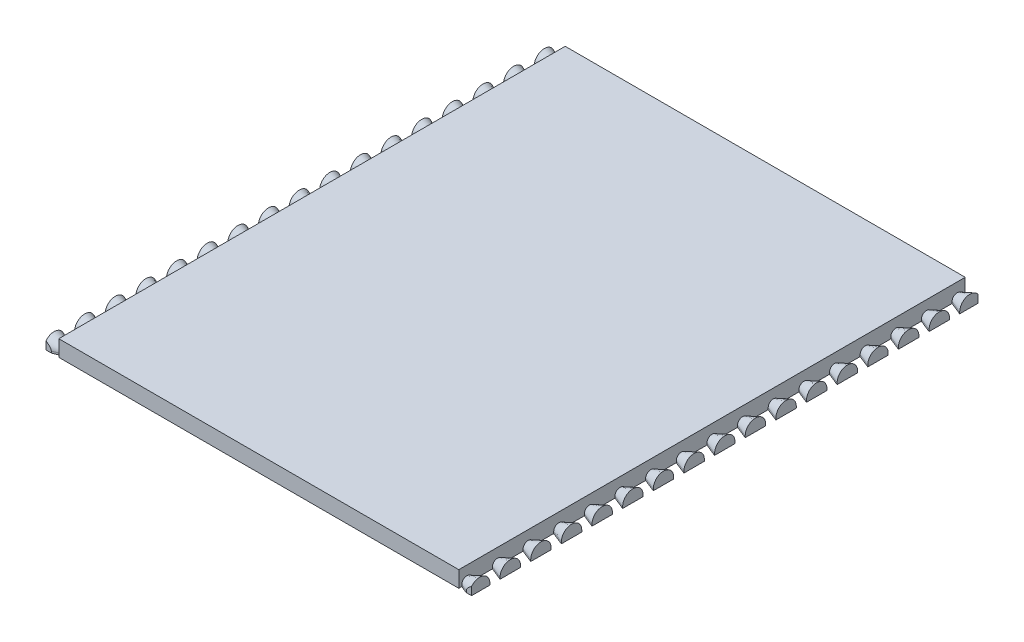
SolidWorks part; units mm, degrees
ref_plane "Alzado" through (0, 0, 0) normal (0, 0, 1) x (1, 0, 0)
ref_plane "Planta" through (0, 0, 0) normal (0, 1, 0) x (1, 0, 0)
ref_plane "Vista lateral" through (0, 0, 0) normal (1, 0, 0) x (0, 0, -1)
sketch "Croquis1" plane through (0, 0, 0) normal (0, 0, 1) x (1, 0, 0)
  line L0 (250, 9.5) -> (-250, -9.5) construction
  line L1 (-250, 9.5) -> (250, 9.5)
  line L2 (-250, 9.5) -> (-250, -9.5)
  line L3 (-250, -9.5) -> (250, -9.5)
  line L4 (250, 9.5) -> (250, -9.5)
extrude "Extruir1" add sketch "Croquis1" along normal mid plane 595
sketch "Croquis2" plane through (0, -9.5, 0) normal (0, -1, 0) x (1, 0, 0)
  line L0 (0, 0) -> (-290.8345, 0) construction
  line L1 (-250, 12) -> (-250, 24)
  line L3 (-250, 297.5) -> (-250, -297.5) construction
  line L4 (-250, 12) -> (-235, 6)
  line L5 (-235, 6) -> (-235, 30)
  line L6 (-235, 30) -> (-250, 24)
  line L7 (-250, 18) -> (-181.4676, 18) construction
  line L8 (0, 0) -> (0, 343.1381) construction
  dimension "D1" = 12
  dimension "D2" = 12
  dimension "D3" = 24
  dimension "D4" = 15
extrude "Cortar-Extruir1" cut sketch "Croquis2" against normal blind 2
sketch "Croquis3" plane through (0, -7.5, 0) normal (0, -1, 0) x (1, 0, 0)
  line L0 (0, 0) -> (-304.3762, 0) construction
  line L4 (-250, 12) -> (-235, 6)
  line L5 (-235, 6) -> (-235, 30)
  line L6 (-235, 30) -> (-250, 24)
  line L7 (-250, 24) -> (-250, 12)
  line L8 (-250, 12) -> (-235, 6)
  line L9 (-235, 6) -> (-235, 30)
  line L10 (-235, 30) -> (-250, 24)
  line L11 (-250, 24) -> (-250, 12)
  dimension "D1" = 0
revolve "Cortar-Revolución1" cut sketch "Croquis3" angle 180 about L0
sketch "Croquis4" plane through (0, 0, -297.5) normal (0, 0, -1) x (-1, 0, 0)
  line L0 (235, -7.5) -> (235, 9.5) construction
  line L1 (250, 4.5) -> (235, -1.5) construction
  line L6 (250, 4.5) -> (235, -1.5)
  line L7 (235, -1.5) -> (235, 9.5)
  line L8 (250, 4.5) -> (250, 9.5)
  line L9 (250, 9.5) -> (235, 9.5)
  line L10 (0, 0) -> (0, 45.23) construction
extrude "Cortar-Extruir2" cut sketch "Croquis4" against normal through all
sketch "Croquis5" plane through (0, -7.5, 0) normal (0, 1, 0) x (1, 0, 0)
  line L4 (-250, 24) -> (-250, 12)
  line L5 (-250, 12) -> (-235, 6)
  line L6 (-235, 6) -> (-235, 30)
  line L7 (-235, 30) -> (-250, 24)
  line L8 (-250, 24) -> (-250, 12)
  line L9 (-250, 12) -> (-235, 6)
  line L10 (-235, 6) -> (-235, 30)
  line L11 (-235, 30) -> (-250, 24)
  dimension "D1" = 0
extrude "Cortar-Extruir3" cut sketch "Croquis5" against normal through all
mirror "Simetría10" about plane through (0, 0, 0) normal (1, 0, 0) of "Cortar-Extruir1"
sketch "Croquis6" plane through (0, -7.5, 0) normal (0, -1, 0) x (1, 0, 0)
  line L0 (0, 0) -> (307.5555, 0) construction
  line L4 (235, 6) -> (250, 12)
  line L5 (250, 12) -> (250, 24)
  line L6 (250, 24) -> (235, 30)
  line L7 (235, 30) -> (235, 6)
  line L8 (235, 6) -> (250, 12)
  line L9 (250, 12) -> (250, 24)
  line L10 (250, 24) -> (235, 30)
  line L11 (235, 30) -> (235, 6)
  dimension "D1" = 0
revolve "Cortar-Revolución2" cut sketch "Croquis6" angle 180 about L0
sketch "Croquis7" plane through (0, 0, 297.5) normal (0, 0, 1) x (1, 0, 0)
  line L0 (235, -1.5) -> (250, 4.5)
  line L1 (250, 4.5) -> (250, 9.5)
  line L2 (250, 9.5) -> (235, 9.5)
  line L3 (235, 9.5) -> (235, -1.5)
extrude "Cortar-Extruir4" cut sketch "Croquis7" against normal through all
pattern_linear "MatrizL4" count 9 spacing 36 along (0, 0, 1) of "Cortar-Extruir1", "Cortar-Revolución1", "Simetría10", "Cortar-Revolución2"
mirror "Simetría9" about plane through (0, 0, 0) normal (0, 0, 1) of "MatrizL4", "Simetría10"
